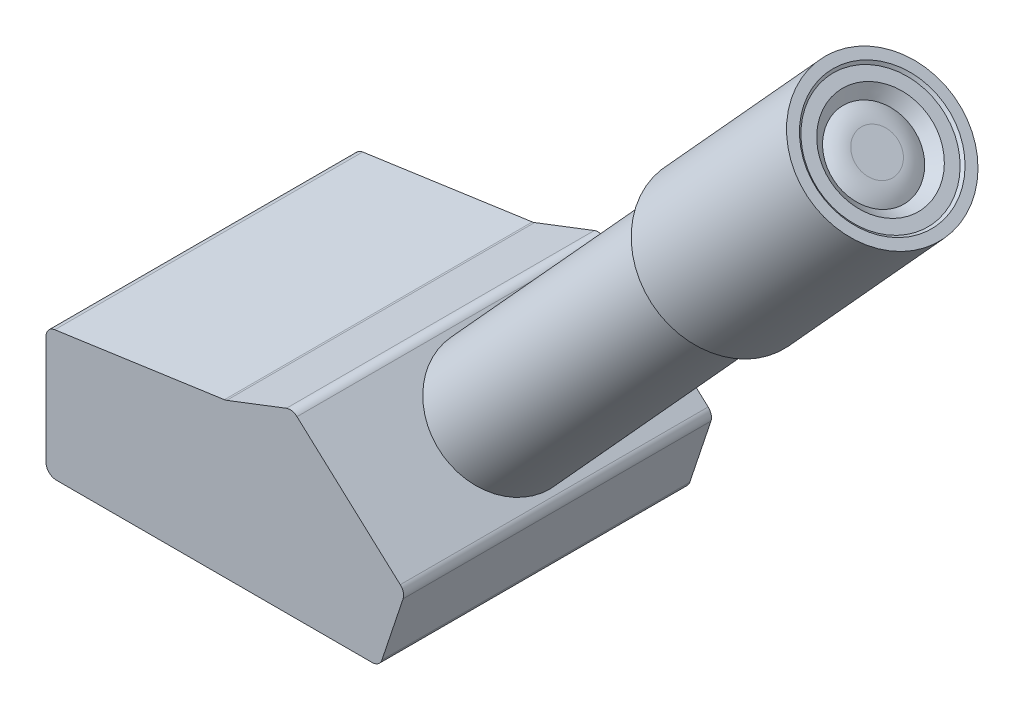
SolidWorks part; units mm, degrees
ref_plane "Plan de face" through (0, 0, 0) normal (0, 0, 1) x (1, 0, 0)
ref_plane "Plan de dessus" through (0, 0, 0) normal (0, 1, 0) x (1, 0, 0)
ref_plane "Plan de droite" through (0, 0, 0) normal (1, 0, 0) x (0, 0, -1)
sketch "Esquisse1" plane through (0, 0, 0) normal (0, 0, 1) x (1, 0, 0)
  line L0 (37.653, 15) -> (111.2317, 15) construction
  line L1 (2, 0) -> (63.5585, 0)
  line L2 (0, 2) -> (0, 23.2654)
  line L4 (0, 35) -> (70, 35) construction
  line L5 (65.4558, 1.3675) -> (69.588, 13.764)
  line L6 (70, 37.4802) -> (70, -7.427) construction
  line L7 (48, 77.2058) -> (48, -12.954) construction
  line L8 (69.036, 15.8764) -> (48.9124, 34.1705)
  line L9 (18.3544, 30) -> (59.608, 30) construction
  line L10 (35, 49.5947) -> (35, 46.8384) construction
  line L11 (35, 46.8384) -> (35, 18.6315) construction
  line L12 (46.8491, 34.5573) -> (35.2112, 30.0812)
  line L13 (34.776, 29.968) -> (1.7172, 25.2453)
  arc A0 (1.7172, 25.2453) -> (0, 23.2654) centre (2, 23.2654) ccw
  arc A1 (48.9124, 34.1705) -> (46.8491, 34.5573) centre (47.5671, 32.6907) ccw
  arc A2 (35.2112, 30.0812) -> (34.776, 29.968) centre (34.4932, 31.9479) cw
  arc A3 (69.588, 13.764) -> (69.036, 15.8764) centre (67.6906, 14.3965) ccw
  arc A4 (63.5585, 0) -> (65.4558, 1.3675) centre (63.5585, 2) ccw
  arc A5 (0, 2) -> (2, 0) centre (2, 2) ccw
  point P22 (0, 25)
  point P25 (48, 35)
  point P28 (35, 30)
  point P31 (70, 15)
  point P34 (65, 0)
  point P37 (0, 0)
  dimension "D8" = 2
  dimension "D1" = 65
  dimension "D2" = 25
  dimension "D3" = 48
  dimension "D4" = 15
  dimension "D5" = 35
  dimension "D6" = 35
  dimension "D7" = 30
extrude "Extrusion1" add sketch "Esquisse1" along normal blind 60
sketch "Esquisse2" plane through (39.1403, 43.0543, 0) normal (0.6727, 0.7399, 0) x (-0.7399, 0.6727, 0)
  line L0 (-26.8048, 60) -> (-26.8048, 0) construction
  line L1 (-40.4029, 60) -> (-13.2067, 60) construction
  line L2 (-40.4029, 0) -> (-13.2067, 0) construction
  circle A0 centre (-26.8048, 30) radius 12.5
  dimension "D1" = 25
extrude "Extrusion2" add sketch "Esquisse2" along normal blind 65
sketch "Esquisse3" plane through (82.864, 91.1504, 0) normal (0.6727, 0.7399, 0) x (-0.7399, 0.6727, 0)
  circle A0 centre (-26.8048, 30) radius 15
extrude "Extrusion3" add sketch "Esquisse3" along normal blind 45
sketch "Esquisse4" plane through (113.1343, 124.4477, 0) normal (0.6727, 0.7399, 0) x (-0.7399, 0.6727, 0)
  circle A0 centre (-26.8048, 30) radius 12.9728
extrude "Enlèv. mat.-Extru.1" cut sketch "Esquisse4" against normal blind 0.5 draft 45
sketch "Esquisse5" plane through (112.7979, 124.0777, 0) normal (0.6727, 0.7399, 0) x (-0.7399, 0.6727, 0)
  circle A0 centre (-26.8048, 30) radius 10
extrude "Enlèv. mat.-Extru.2" cut sketch "Esquisse5" against normal blind 2 draft 45
sketch "Esquisse6" plane through (111.4526, 122.5979, 0) normal (0.6727, 0.7399, 0) x (-0.7399, 0.6727, 0)
  circle A0 centre (-26.8048, 30) radius 8
extrude "Extrusion5" add sketch "Esquisse6" along normal blind 1
fillet "Congé1" radius 8 1 edges at (126.0397, 110.6883, 30)
sketch "Esquisse7" plane through (0, 0, 0) normal (0, -1, 0) x (1, 0, 0)
  line L0 (63.5585, 30) -> (2, 30) construction
  line L1 (63.5585, 60) -> (63.5585, 0) construction
  line L2 (2, 60) -> (2, 0) construction
  line L3 (0, 60) -> (0, 0) construction
  circle A0 centre (40, 30) radius 10
  dimension "D1" = 40
extrude "Extrusion6" add sketch "Esquisse7" along normal blind 10
